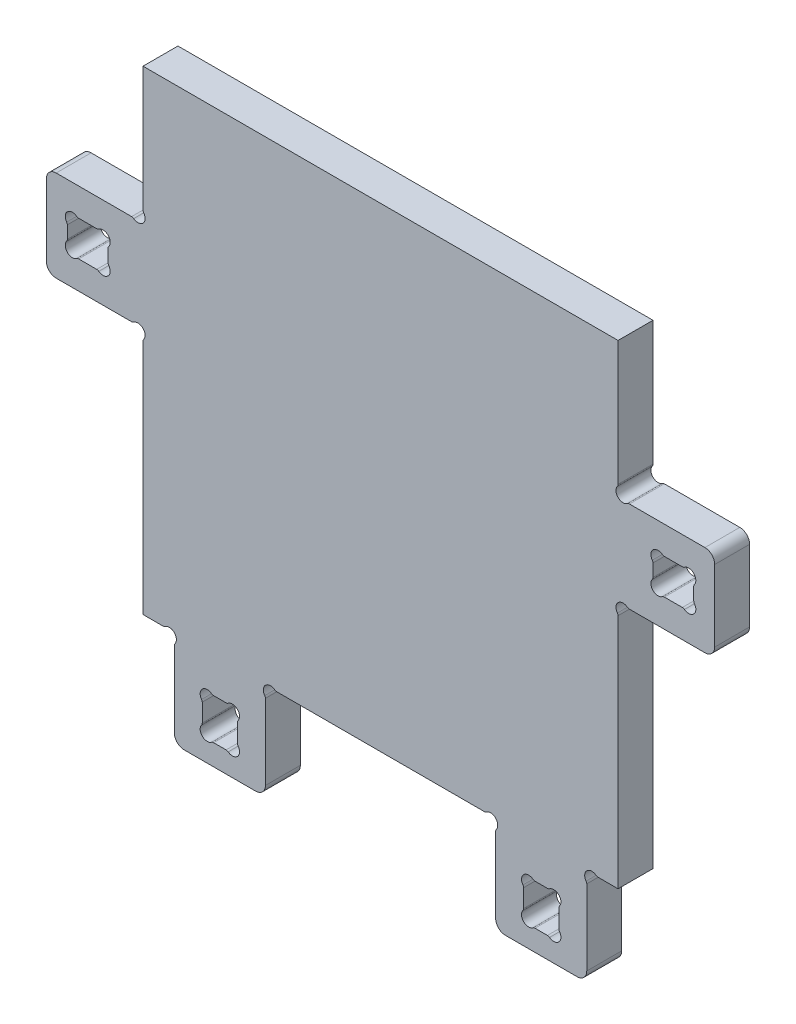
SolidWorks part; units mm, degrees
ref_plane "Plan de face" through (0, 0, 0) normal (0, 0, 1) x (1, 0, 0)
ref_plane "Plan de dessus" through (0, 0, 0) normal (0, 1, 0) x (1, 0, 0)
ref_plane "Plan de droite" through (0, 0, 0) normal (1, 0, 0) x (0, 0, -1)
sketch "Esquisse2" plane through (0, 0, 0) normal (0, 0, 1) x (1, 0, 0)
  line L0 (0, 69.1667) -> (-3.6062, 65.5604) construction
  line L2 (0, 0) -> (65.2, 0)
  line L3 (0, 0) -> (0, 61.0356)
  line L4 (32.6, 27.6) -> (32.6, 15) construction
  line L5 (73.331, 69.1667) -> (147.6, 69.1667)
  line L6 (45.2, 36.0356) -> (45.2, 23.131)
  line L7 (65.2, 69.1667) -> (68.8062, 65.5604) construction
  line L8 (-8.131, 69.1667) -> (-22.4, 69.1667)
  line L9 (28.131, 44.1667) -> (37.069, 44.1667)
  line L10 (20, 29.5833) -> (45.2, 29.5833) construction
  line L11 (20, 36.0356) -> (20, 23.131)
  line L12 (65.2, 0) -> (65.2, 61.0356)
  line L13 (28.131, 15) -> (37.069, 15)
  line L14 (20, 15) -> (32.6, 27.6) construction
  line L15 (-22.4, 311.7667) -> (-26.0062, 315.3729) construction
  line L16 (-91.5667, 311.7667) -> (-91.5667, 246.5667)
  line L17 (-91.5667, 311.7667) -> (-30.531, 311.7667)
  line L18 (-63.9667, 279.1667) -> (-76.5667, 279.1667) construction
  line L19 (-22.4, 238.4356) -> (-22.4, 69.1667)
  line L20 (-55.531, 266.5667) -> (-68.4356, 266.5667)
  line L21 (-22.4, 246.5667) -> (-26.0062, 242.9604) construction
  line L22 (-22.4, 319.8977) -> (-22.4, 409.0667)
  line L23 (-47.4, 283.6356) -> (-47.4, 274.6977)
  line L24 (-61.9833, 291.7667) -> (-61.9833, 266.5667) construction
  line L25 (-55.531, 291.7667) -> (-68.4356, 291.7667)
  line L26 (-91.5667, 246.5667) -> (-30.531, 246.5667)
  line L27 (-76.5667, 283.6356) -> (-76.5667, 274.6977)
  line L28 (-76.5667, 291.7667) -> (-63.9667, 279.1667) construction
  line L29 (-22.4, 409.0667) -> (147.6, 409.0667)
  line L30 (147.6, 409.0667) -> (147.6, 69.1667)
  line L31 (195.6232, 69.1667) -> (195.6232, 409.0667) construction
  line L32 (195.6232, 24.0667) -> (195.6232, 44.0667) construction
  line L33 (195.6232, 44.0667) -> (195.6232, 69.1667) construction
  arc A0 (0.4914, 62.524) -> (-6.6426, 69.658) centre (-3.6062, 65.5604) ccw
  arc A1 (0, 61.0356) -> (0.4914, 62.524) centre (2.5, 61.0356) cw
  arc A2 (-6.6426, 69.658) -> (-8.131, 69.1667) centre (-8.131, 71.6667) cw
  arc A3 (71.8426, 69.658) -> (64.7086, 62.524) centre (68.8062, 65.5604) ccw
  arc A4 (71.8426, 69.658) -> (73.331, 69.1667) centre (73.331, 71.6667) ccw
  arc A5 (64.7086, 62.524) -> (65.2, 61.0356) centre (62.7, 61.0356) cw
  arc A6 (19.5086, 21.6426) -> (26.6426, 14.5086) centre (23.6062, 18.6062) ccw
  arc A7 (19.5086, 21.6426) -> (20, 23.131) centre (17.5, 23.131) ccw
  arc A8 (26.6426, 14.5086) -> (28.131, 15) centre (28.131, 12.5) cw
  arc A9 (38.5574, 14.5086) -> (37.069, 15) centre (37.069, 12.5) ccw
  arc A10 (45.6914, 21.6426) -> (38.5574, 14.5086) centre (41.5938, 18.6062) cw
  arc A11 (45.6914, 21.6426) -> (45.2, 23.131) centre (47.7, 23.131) cw
  arc A12 (45.6914, 37.524) -> (45.2, 36.0356) centre (47.7, 36.0356) ccw
  arc A13 (45.6914, 37.524) -> (38.5574, 44.658) centre (41.5938, 40.5604) ccw
  arc A14 (38.5574, 44.658) -> (37.069, 44.1667) centre (37.069, 46.6667) cw
  arc A15 (26.6426, 44.658) -> (28.131, 44.1667) centre (28.131, 46.6667) ccw
  arc A16 (19.5086, 37.524) -> (26.6426, 44.658) centre (23.6062, 40.5604) cw
  arc A17 (19.5086, 37.524) -> (20, 36.0356) centre (17.5, 36.0356) cw
  arc A18 (-29.0426, 311.2753) -> (-21.9086, 318.4093) centre (-26.0062, 315.3729) ccw
  arc A19 (-30.531, 311.7667) -> (-29.0426, 311.2753) centre (-30.531, 309.2667) cw
  arc A20 (-21.9086, 318.4093) -> (-22.4, 319.8977) centre (-19.9, 319.8977) cw
  arc A21 (-21.9086, 239.924) -> (-29.0426, 247.058) centre (-26.0062, 242.9604) ccw
  arc A22 (-21.9086, 239.924) -> (-22.4, 238.4356) centre (-19.9, 238.4356) ccw
  arc A23 (-29.0426, 247.058) -> (-30.531, 246.5667) centre (-30.531, 249.0667) cw
  arc A24 (-69.924, 292.258) -> (-77.058, 285.124) centre (-72.9604, 288.1604) ccw
  arc A25 (-69.924, 292.258) -> (-68.4356, 291.7667) centre (-68.4356, 294.2667) ccw
  arc A26 (-77.058, 285.124) -> (-76.5667, 283.6356) centre (-79.0667, 283.6356) cw
  arc A27 (-77.058, 273.2093) -> (-76.5667, 274.6977) centre (-79.0667, 274.6977) ccw
  arc A28 (-69.924, 266.0753) -> (-77.058, 273.2093) centre (-72.9604, 270.1729) cw
  arc A29 (-69.924, 266.0753) -> (-68.4356, 266.5667) centre (-68.4356, 264.0667) cw
  arc A30 (-54.0426, 266.0753) -> (-55.531, 266.5667) centre (-55.531, 264.0667) ccw
  arc A31 (-54.0426, 266.0753) -> (-46.9086, 273.2093) centre (-51.0062, 270.1729) ccw
  arc A32 (-46.9086, 273.2093) -> (-47.4, 274.6977) centre (-44.9, 274.6977) cw
  arc A33 (-46.9086, 285.124) -> (-47.4, 283.6356) centre (-44.9, 283.6356) ccw
  arc A34 (-54.0426, 292.258) -> (-46.9086, 285.124) centre (-51.0062, 288.1604) cw
  arc A35 (-54.0426, 292.258) -> (-55.531, 291.7667) centre (-55.531, 294.2667) cw
  point P38 (32.6, 15)
  point P57 (32.6, 0)
  point P92 (-76.5667, 279.1667)
  point P109 (-91.5667, 279.1667)
extrude "Boss.-Extru.2" add sketch "Esquisse2" along normal blind 25
fillet "Congé1" radius 7 4 edges at (0, 0, 12.5) (65.2, 0, 12.5) (-91.5667, 246.5667, 12.5) (-91.5667, 311.7667, 12.5)
mirror "Mirror2" about plane through (147.6, 409.0667, 25) normal (-1, 0, 0)
equation "\"D1@Boss.-Extru.2\" = \"material_thickness\""
equation "\"D2@Esquisse2\"= \"tool_diameter\" / 2 + \"hole_clearance\""
equation "\"tool_diameter\"=10"
equation "\"hole_clearance\"=0.1"
equation "\"material_thickness\"=25"
equation "\"clearance\"=0.1"
equation "\"outer_slot\"=0.5"
equation "\"fillet\"=7"
equation "\"D4@Esquisse2\"=\"material_thickness\"/10"
equation "\"string\"= 2 * \"tool_diameter\" / 2 * cos ( 45deg )"
equation "\"angle\"= IIF ( \"string\" < \"limit\" , 45 , ( 180 - 2 * arcsin ( \"ThicknessVStool_dia\" ) ) / 2 )"
equation "\"limit\"= \"material_thickness\" / 2 * 5 / 6"
equation "\"ThicknessVStool_dia\"= IIF ( \"limit\" / \"tool_diameter\" > 1 , 1 , \"limit\" / \"tool_diameter\" )"
equation "\"D1@Congé1\"= \"fillet\""
equation "\"D10@Esquisse2\"=\"tool_diameter\" / 2 + \"hole_clearance\""
equation "\"D9@Esquisse2\" = \"material_thickness\" / 2 + \"clearance\""
equation "\"D8@Esquisse2\"=\"material_thickness\" / 2*7/6"
equation "\"D11@Esquisse2\"=\"material_thickness\"/10"
equation "\"D7@Esquisse2\"=\"angle\""
equation "\"D14@Esquisse2\"= \"tool_diameter\" / 2 + \"hole_clearance\""
equation "\"D16@Esquisse2\"=\"material_thickness\"/10"
equation "\"D22@Esquisse2\"=\"tool_diameter\" / 2 + \"hole_clearance\""
equation "\"D21@Esquisse2\" = \"material_thickness\" / 2 + \"clearance\""
equation "\"D20@Esquisse2\" = \"material_thickness\" / 2"
equation "\"D23@Esquisse2\"=\"material_thickness\"/10"
equation "\"D19@Esquisse2\"=\"angle\""
equation "\"D20@Esquisse2\"=\"material_thickness\" / 2*7/6"
equation "\"D12@Esquisse2\"=\"material_thickness\""
equation "\"D24@Esquisse2\"=\"material_thickness\""
equation "\"D2\"= \"tool_diameter\" / 2 + \"hole_clearance\""
equation "\"D12\"= \"material_thickness\""
equation "\"D3\"= \"material_thickness\" / 10"
equation "\"D9\"= \"tool_diameter\" / 2 + \"hole_clearance\""
equation "\"D8\"= \"material_thickness\" / 2 + \"clearance\""
equation "\"D7\"= \"material_thickness\" / 2"
equation "\"D10\"= \"material_thickness\" / 10"
equation "\"D6\"= \"angle\""
equation "\"D27@Esquisse2\"=170"
equation "\"D29@Esquisse2\"=\"material_thickness\" +\"clearance\""
